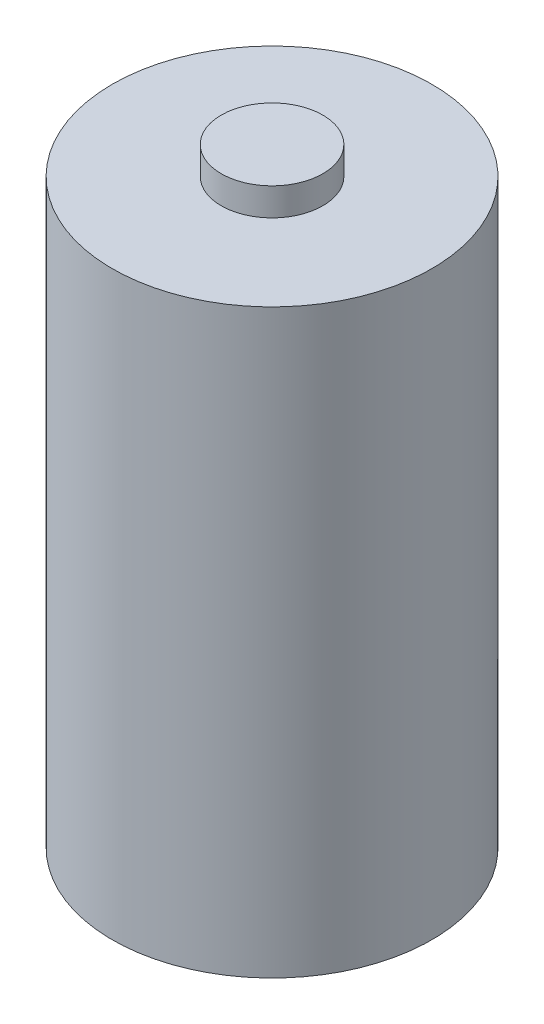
SolidWorks part; units mm, degrees
ref_plane "Frontal Plane" through (0, 0, 0) normal (0, 0, 1) x (1, 0, 0)
ref_plane "Horizontal Plane" through (0, 0, 0) normal (0, 1, 0) x (1, 0, 0)
ref_plane "Profile Plane" through (0, 0, 0) normal (1, 0, 0) x (0, 0, -1)
sketch "Sketch1" plane through (0, 0, 0) normal (0, 0, 1) x (1, 0, 0)
  line L0 (0, 0) -> (15.494, 0)
  line L1 (15.494, 0) -> (15.494, 56.3626)
  line L2 (15.494, 56.3626) -> (4.9276, 56.3626)
  line L3 (4.9276, 56.3626) -> (4.9276, 59.055)
  line L4 (4.9276, 59.055) -> (0, 59.055)
  line L5 (0, 59.055) -> (0, 0)
  line L6 (0, 70.0316) -> (0, -5.9552) construction
  dimension "D1" = 15.494
  dimension "D2" = 59.055
  dimension "D3" = 56.3626
  dimension "D4" = 4.9276
revolve "Revolve1" add sketch "Sketch1" angle 360 about L6
